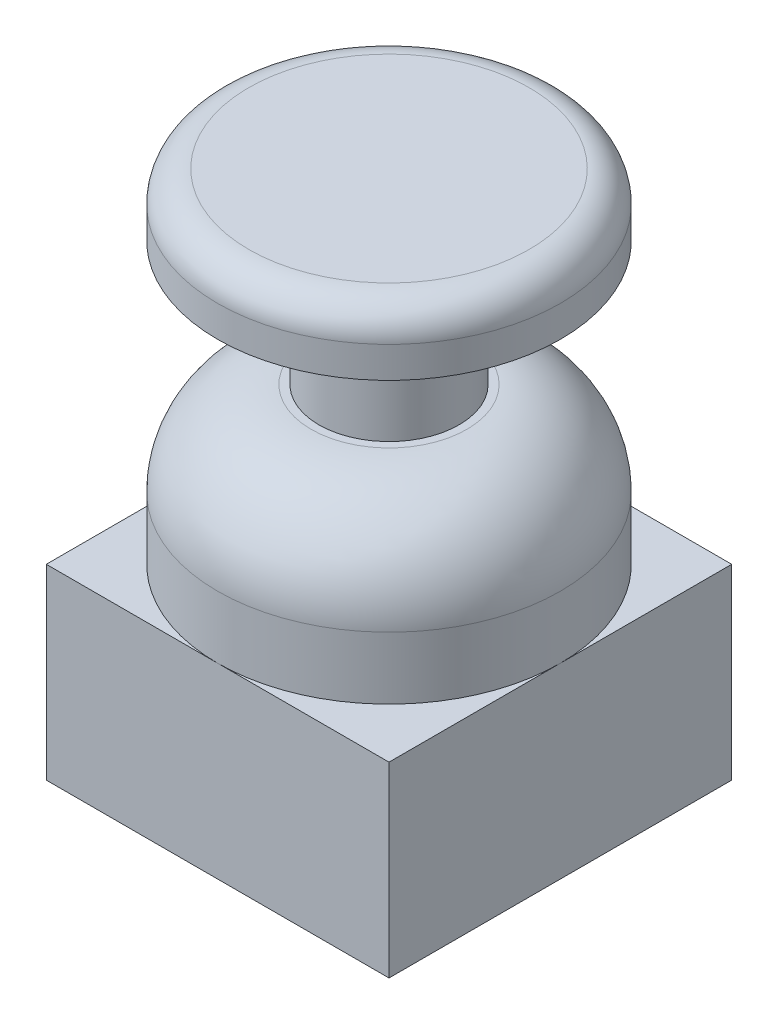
SolidWorks part; units mm, degrees
ref_plane "Front Plane" through (0, 0, 0) normal (0, 0, 1) x (1, 0, 0)
ref_plane "Top Plane" through (0, 0, 0) normal (0, 1, 0) x (1, 0, 0)
ref_plane "Right Plane" through (0, 0, 0) normal (1, 0, 0) x (0, 0, -1)
sketch "Sketch1" plane through (0, 0, 0) normal (0, 0, 1) x (1, 0, 0)
  line L0 (0, 0) -> (-11, 0)
  line L1 (-11, 0) -> (-11, 16)
  line L2 (-5, 22) -> (-4.5, 22)
  line L3 (-4.5, 22) -> (-4.5, 30)
  line L4 (-4.5, 30) -> (-11, 30)
  line L5 (-11, 30) -> (-11, 32)
  line L6 (-9, 34) -> (0, 34)
  line L7 (0, 34) -> (0, 0)
  arc A0 (-11, 16) -> (-5, 22) centre (-5, 16) cw
  arc A1 (-11, 32) -> (-9, 34) centre (-9, 32) cw
  point P11 (-11, 22)
  point P14 (-11, 34)
  dimension "D7" = 6
  dimension "D8" = 2
  dimension "D1" = 22
  dimension "D2" = 8
  dimension "D3" = 4
  dimension "D4" = 11
  dimension "D5" = 4.5
  dimension "D6" = 11
revolve "Stick Revolve" add sketch "Sketch1" angle 360 about L7
sketch "Sketch2" plane through (0, 0, 0) normal (0, -1, 0) x (1, 0, 0)
  line L1 (-11, -11) -> (11, -11)
  line L2 (-11, -11) -> (-11, 11)
  line L3 (-11, 11) -> (11, 11)
  line L4 (11, -11) -> (11, 11)
  line L5 (-11, -11) -> (11, 11) construction
  line L6 (-11, 11) -> (11, -11) construction
  circle A0 centre (0, 0) radius 11 construction
  point P0 (0, 0)
extrude "Switch Base" add sketch "Sketch2" against normal blind 12
